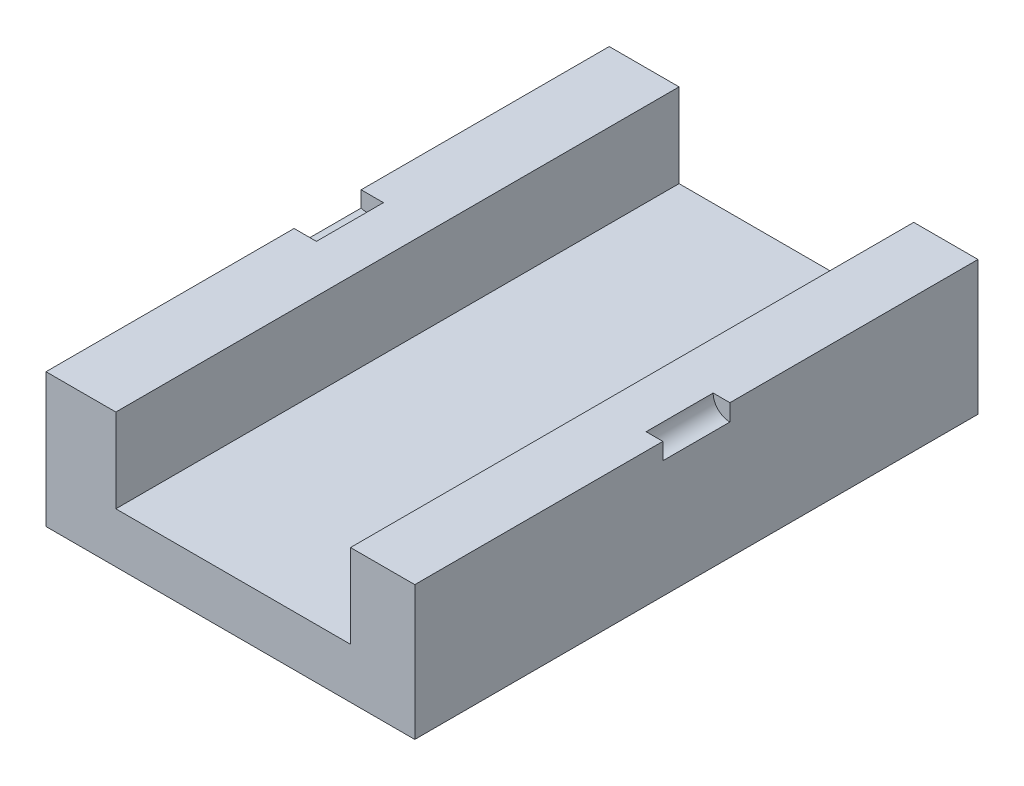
SolidWorks part; units mm, degrees
ref_plane "Front Plane" through (0, 0, 0) normal (0, 0, 1) x (1, 0, 0)
ref_plane "Top Plane" through (0, 0, 0) normal (0, 1, 0) x (1, 0, 0)
ref_plane "Right Plane" through (0, 0, 0) normal (1, 0, 0) x (0, 0, -1)
sketch "Sketch2" plane through (0, 0, 0) normal (0, 0, 1) x (1, 0, 0)
  line L0 (-48.2007, 19.7405) -> (-48.2007, -5.2595)
  line L1 (-48.2007, -5.2595) -> (21.7993, -5.2595)
  line L2 (21.7993, -5.2595) -> (21.7993, 19.7405)
  line L3 (21.7993, 19.7405) -> (40.9689, 19.7405)
  line L4 (40.9689, 19.7405) -> (40.9689, -20.2595)
  line L5 (40.9689, -20.2595) -> (-69.0311, -20.2595)
  line L6 (-69.0311, -20.2595) -> (-69.0311, 19.7405)
  line L7 (-69.0311, 19.7405) -> (-48.2007, 19.7405)
  dimension "D1" = 70
  dimension "D2" = 110
  dimension "D3" = 40
  dimension "D4" = 25
  dimension "D5" = 25
  dimension "D6" = 40
extrude "Boss-Extrude1" add sketch "Sketch2" along normal mid plane 168
sketch "Sketch3" plane through (40.9689, 0, 0) normal (1, 0, 0) x (0, 0, -1)
  line L0 (-18.3384, 19.7405) -> (22.6896, 19.7405) construction
  line L1 (-84, 19.7405) -> (84, 19.7405) construction
  line L2 (10, 19.7405) -> (-10, 19.7405)
  line L4 (-10, 19.7405) -> (-10, 14.7405)
  line L5 (-10, 14.7405) -> (10, 14.7405)
  line L6 (10, 19.7405) -> (10, 14.7405)
  dimension "D1" = 10
  dimension "D2" = 10
  dimension "D3" = 5
revolve "Cut-Revolve1" cut sketch "Sketch3" angle 360 about L0
ref_plane "Plane1" through (-13.2007, 0, 0) normal (1, 0, 0) x (0, 0, -1)
mirror "Mirror1" about plane through (-13.2007, 0, 0) normal (1, 0, 0) of "Cut-Revolve1"
